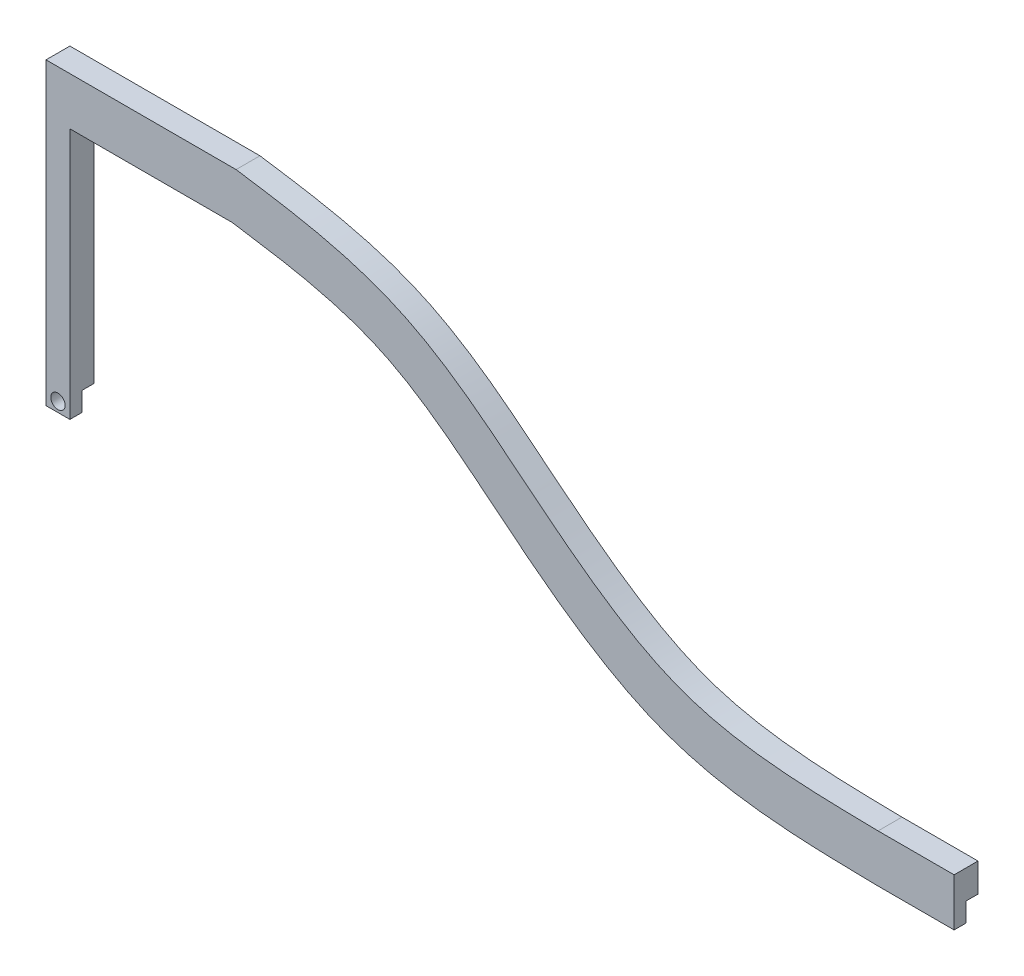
SolidWorks part; units mm, degrees
ref_plane "Front Plane" through (0, 0, 0) normal (0, 0, 1) x (1, 0, 0)
ref_plane "Top Plane" through (0, 0, 0) normal (0, 1, 0) x (1, 0, 0)
ref_plane "Right Plane" through (0, 0, 0) normal (1, 0, 0) x (0, 0, -1)
sketch "Sketch2" plane through (0, 0, 0) normal (0, 0, 1) x (1, 0, 0)
  line L0 (0, 0) -> (0, 13.3821)
  line L1 (0, 13.3821) -> (8.6425, 13.3821)
  line L2 (42.9413, 0) -> (47.0053, 0)
  spline S0 degree 3 poles (8.6425, 13.3821) (11.3837, 12.9651) (16.6168, 12.169) (23.4661, 6.449) (31.479, 0.1898) (39.0643, 0.0642) (42.9413, 0) knots 0 0 0 0 0.216097 0.412538 0.699741 1 1 1 1
extrude "Extrude-Thin1" add sketch "Sketch2" along normal blind 1.27 thin
sketch "Sketch3" plane through (0, 0, 1.27) normal (0, 0, 1) x (1, 0, 0)
  line L0 (-1.27, 0) -> (-1.27, 15.9221)
  line L1 (0, 0) -> (-2.54, 0) construction
  line L2 (-2.54, 15.9221) -> (8.8346, 15.9221) construction
extrude "Extrude1" cut sketch "Sketch3" against normal through all and the other way through all
sketch "Sketch4" plane through (0, 0, 1.27) normal (0, 0, 1) x (1, 0, 0)
  circle A0 centre (-0.635, 0.517) radius 0.381
extrude "Extrude2" cut sketch "Sketch4" against normal through all
sketch "Sketch7" plane through (0, 0, 0) normal (1, 0, 0) x (0, 0, -1)
  line L0 (-0.635, 0) -> (-0.635, 1.016)
  line L1 (-1.27, 0) -> (0, 0) construction
  line L2 (-0.635, 1.016) -> (0, 1.016)
  line L3 (0, 0) -> (0, 13.3821) construction
extrude "Extrude5" cut sketch "Sketch7" against normal through all and the other way through all flip side to cut
